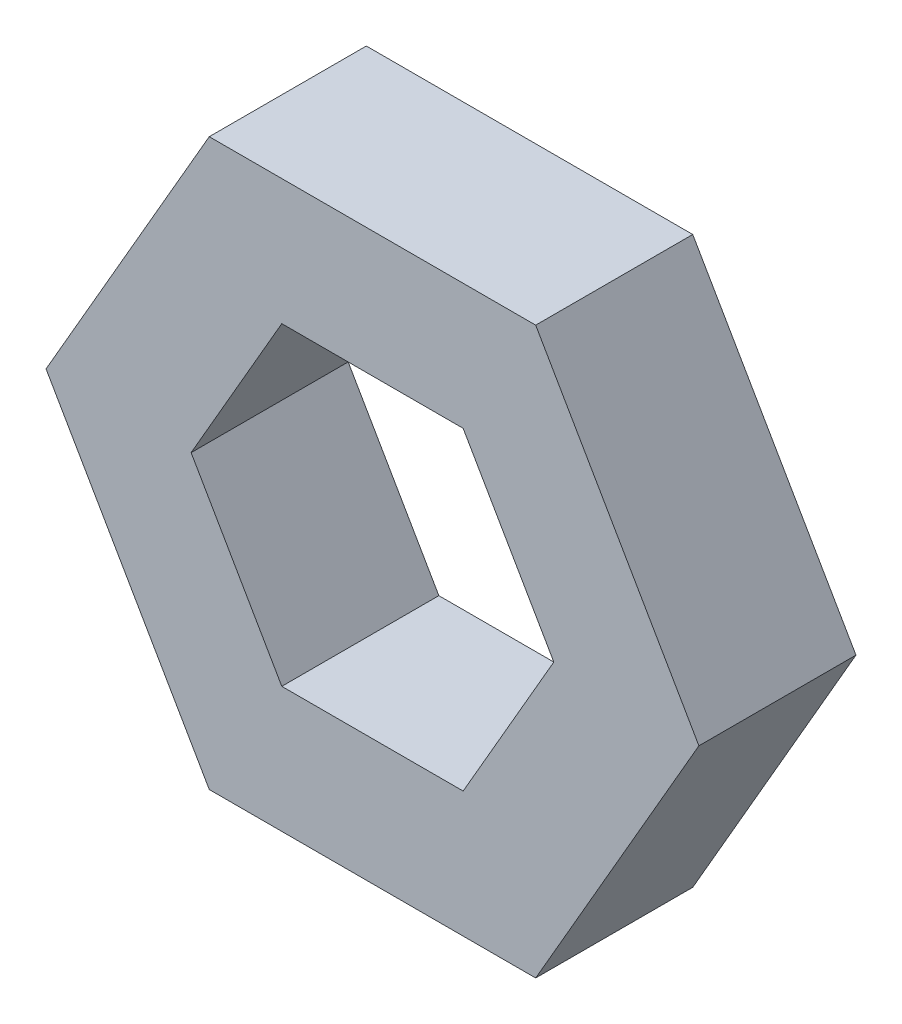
SolidWorks part; units mm, degrees
ref_plane "Front" through (0, 0, 0) normal (0, 0, 1) x (1, 0, 0)
ref_plane "Top" through (0, 0, 0) normal (0, 1, 0) x (1, 0, 0)
ref_plane "Right" through (0, 0, 0) normal (1, 0, 0) x (0, 0, -1)
sketch "Sketch1" plane through (0, 0, 0) normal (0, 0, 1) x (1, 0, 0)
  line L0 (6.5991, 0) -> (3.2996, 5.715)
  line L1 (3.6662, 0) -> (1.8331, 3.175)
  line L2 (1.8331, 3.175) -> (-1.8331, 3.175)
  line L3 (-1.8331, 3.175) -> (-3.6662, 0)
  line L4 (-3.6662, 0) -> (-1.8331, -3.175)
  line L5 (-1.8331, -3.175) -> (1.8331, -3.175)
  line L6 (1.8331, -3.175) -> (3.6662, 0)
  line L7 (3.2996, 5.715) -> (-3.2996, 5.715)
  line L8 (-3.2996, 5.715) -> (-6.5991, 0)
  line L9 (-6.5991, 0) -> (-3.2996, -5.715)
  line L10 (-3.2996, -5.715) -> (3.2996, -5.715)
  line L11 (3.2996, -5.715) -> (6.5991, 0)
  circle A0 centre (0, 0) radius 3.175 construction
  circle A1 centre (0, 0) radius 5.715 construction
  dimension "D1" = 6.35
  dimension "D2" = 2.54
extrude "Boss-Extrude1" add sketch "Sketch1" along normal blind 3.175
